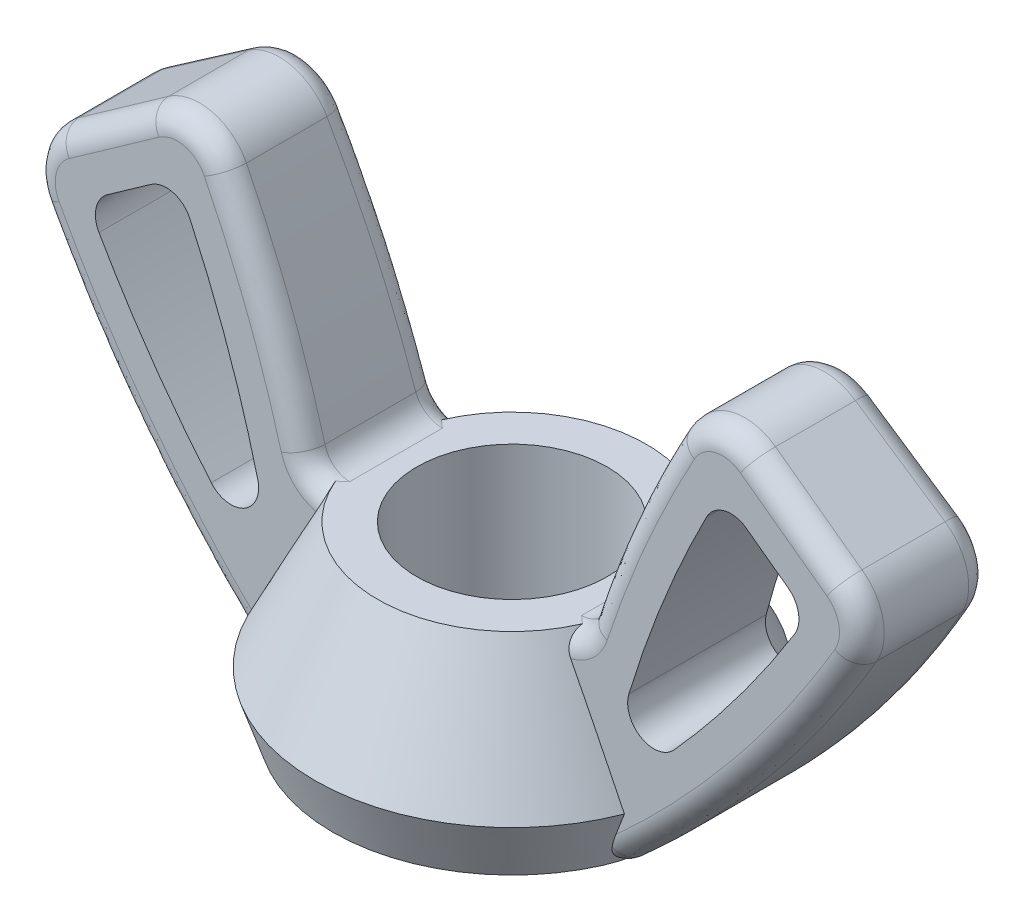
SolidWorks part; units mm, degrees
ref_plane "Front Plane" through (0, 0, 0) normal (0, 0, 1) x (1, 0, 0)
ref_plane "Top Plane" through (0, 0, 0) normal (0, 1, 0) x (1, 0, 0)
ref_plane "Right Plane" through (0, 0, 0) normal (1, 0, 0) x (0, 0, -1)
other "Configuration Table"
sketch "BaseNutSke" plane through (0, 0, 0) normal (0, 0, 1) x (1, 0, 0)
  line L0 (0, 0) -> (-8, 0)
  line L2 (-6, 8) -> (0, 8)
  line L3 (0, 8) -> (0, 0)
  line L4 (0, -38.5148) -> (0, 38.5148) construction
  line L5 (-6, 8) -> (-8.8, 2.4)
  line L6 (-8.8, 2.4) -> (-8, 0)
revolve "BaseNut" add sketch "BaseNutSke" angle 360 about L4
sketch "BaseWingSke" plane through (0, 0, 0) normal (1, 0, 0) x (0, 0, -1)
  line L0 (0, 0) -> (0, 62.8635) construction
  line L1 (-2.75, 19) -> (-3.25, 0)
  line L2 (-2.75, 19) -> (2.75, 19)
  line L3 (2.75, 19) -> (3.25, 0)
  line L4 (3.25, 0) -> (-3.25, 0)
  point P8 (0, 19)
  dimension "TopWing_Width" = 5.5
  dimension "BottomWing_Width" = 6.5
  dimension "Height" = 19
extrude "BaseWing" add sketch "BaseWingSke" along normal mid plane 37
sketch "CutWingSke" plane through (0, 0, 0) normal (0, 0, 1) x (1, 0, 0)
  line L0 (0, 0) -> (0, 84.5075) construction
  line L3 (18.5, 19) -> (-18.5, 19) construction
  line L4 (-18.5, 19) -> (-18.5, 0) construction
  line L5 (-7.3101, 0) -> (7.3101, 0) construction
  line L6 (5.1732, 8) -> (-5.1732, 8) construction
  line L7 (13.5447, 18.566) -> (17.4766, 15.8128)
  line L8 (-13.5447, 18.566) -> (-17.4766, 15.8128)
  line L9 (-7.3101, 0) -> (-18.5, 0) construction
  line L10 (-28.5, 29) -> (28.5, 29)
  line L11 (-28.5, 29) -> (-28.5, -10)
  line L12 (-28.5, -10) -> (28.5, -10)
  line L13 (28.5, 29) -> (28.5, -10)
  line L14 (18.5, 19) -> (18.5, 0) construction
  line L16 (-7.3101, 0) -> (7.3101, 0)
  line L17 (5.1732, 8) -> (-5.1732, 8)
  arc A0 (-5.1732, 8) -> (-6.3192, 8.8442) centre (-5.1732, 9.2) cw
  arc A1 (-7.3101, 0) -> (-8.1072, 0.303) centre (-7.3101, 1.2) cw
  arc A2 (-17.4766, 15.8128) -> (-18.1775, 12.6452) centre (-16.1, 13.8468) ccw
  arc A3 (-10.0553, 17.7386) -> (-13.5447, 18.566) centre (-12.1681, 16.6) ccw
  arc A4 (-10.0553, 17.7386) -> (-6.3192, 8.8442) centre (-54.0704, -5.9821) cw
  arc A5 (-18.1775, 12.6452) -> (-8.1072, 0.303) centre (25.1037, 37.68) ccw
  arc A6 (7.3101, 0) -> (8.1072, 0.303) centre (7.3101, 1.2) ccw
  arc A7 (18.1775, 12.6452) -> (8.1072, 0.303) centre (-25.1037, 37.68) cw
  arc A8 (17.4766, 15.8128) -> (18.1775, 12.6452) centre (16.1, 13.8468) cw
  arc A9 (10.0553, 17.7386) -> (13.5447, 18.566) centre (12.1681, 16.6) cw
  arc A10 (10.0553, 17.7386) -> (6.3192, 8.8442) centre (54.0704, -5.9821) ccw
  arc A11 (5.1732, 8) -> (6.3192, 8.8442) centre (5.1732, 9.2) ccw
extrude "CutWing" cut sketch "CutWingSke" against normal mid plane 37
sketch "HoleSke" plane through (0, 0, 0) normal (0, 1, 0) x (1, 0, 0)
  circle A0 centre (0, 0) radius 4.25
extrude "TappedHole" cut sketch "HoleSke" along normal through all
chamfer "Chamfer1" distance 0.5667 angle 60 1 edges at (0, 0, 4.25)
sketch "HollowSke" plane through (0, 0, 0) normal (0, 0, 1) x (1, 0, 0)
  line L0 (-13.2891, 15.815) -> (-15.1878, 14.4855)
  line L1 (13.2891, 15.815) -> (15.1878, 14.4855)
  line L2 (-13.5447, 18.566) -> (-17.4766, 15.8128) construction
  line L3 (0, 0) -> (0, 22.0794) construction
  arc A0 (-11.5283, 15.3704) -> (-8.282, 7.0249) centre (-54.0704, -5.9821) cw
  arc A1 (-15.5238, 12.8773) -> (-10.3296, 5.8957) centre (25.1037, 37.68) ccw
  arc A4 (-6.3192, 8.8442) -> (-10.0553, 17.7386) centre (-54.0704, -5.9821) ccw construction
  arc A5 (-18.1775, 12.6452) -> (-8.1072, 0.303) centre (25.1037, 37.68) ccw construction
  arc A6 (-13.2891, 15.815) -> (-11.5283, 15.3704) centre (-12.6008, 14.8321) cw
  arc A7 (-15.1878, 14.4855) -> (-15.5238, 12.8773) centre (-14.4995, 13.5026) ccw
  arc A8 (-8.282, 7.0249) -> (-10.3296, 5.8957) centre (-9.4364, 6.697) cw
  arc A9 (8.282, 7.0249) -> (10.3296, 5.8957) centre (9.4364, 6.697) ccw
  arc A10 (15.5238, 12.8773) -> (10.3296, 5.8957) centre (-25.1037, 37.68) cw
  arc A11 (15.1878, 14.4855) -> (15.5238, 12.8773) centre (14.4995, 13.5026) cw
  arc A12 (13.2891, 15.815) -> (11.5283, 15.3704) centre (12.6008, 14.8321) ccw
  arc A13 (11.5283, 15.3704) -> (8.282, 7.0249) centre (54.0704, -5.9821) ccw
extrude "HollowWing" cut sketch "HollowSke" against normal mid plane 10
fillet "Fillet1" radius 1 28 edges at (7.7364, 0.0783, -3.2479) (13.637, 6.0704, -3.0903) (18.4433, 14.3653, -2.872) (15.5106, 17.1894, -2.7976) (11.6143, 18.9352, -2.7517) (5.8849, 8.2338, -3.0333) (5.8849, 8.2338, 3.0333) (7.7364, 0.0783, 3.2479) (13.637, 6.0704, 3.0903) (18.4433, 14.3653, 2.872) (15.5106, 17.1894, 2.7976) (11.6143, 18.9352, 2.7517) (-5.8849, 8.2338, -3.0333) (-7.7364, 0.0783, -3.2479) (-13.637, 6.0704, -3.0903) (-18.4433, 14.3653, -2.872) (-15.5106, 17.1894, -2.7976) (-11.6143, 18.9352, -2.7517) (-7.7364, 0.0783, 3.2479) (-13.637, 6.0704, 3.0903) (-18.4433, 14.3653, 2.872) (-15.5106, 17.1894, 2.7976) (-11.6143, 18.9352, 2.7517) (-5.8849, 8.2338, 3.0333) (7.9723, 13.3817, -2.8978) (7.9723, 13.3817, 2.8978) (-7.9723, 13.3817, -2.8978) (-7.9723, 13.3817, 2.8978)
sketch "ThdSchSke" plane through (0, 0, 0) normal (0, 0, 1) x (1, 0, 0)
  line L0 (4.25, 0.5667) -> (3.384, 0.5667)
  line L1 (3.384, 0.5667) -> (3.384, 1.4327)
  line L2 (3.384, 1.4327) -> (4.25, 1.4327)
  line L3 (4.25, 1.4327) -> (5, 0.9997)
  line L4 (5, 0.9997) -> (4.25, 0.5667)
  line L5 (0, -3.4614) -> (0, 8.4929) construction
  line L6 (-4.25, 0.5667) -> (4.25, 0.5667) construction
revolve "ThreadSchematic" [suppressed] cut sketch "ThdSchSke" angle 360 about L5
pattern_linear "ThdSchPat" [suppressed]
equation "\"D1@BaseNutSke\" = \"Nut_Height@BaseNutSke\"*0.7"
equation "\"D2@BaseNutSke\" = \"Bottom_Width@BaseNutSke\"*1.1"
equation "\"D5@CutWingSke\" = \"Top_Width@BaseNutSke\"/10"
equation "\"D7@CutWingSke\" = \"Top_Width@BaseNutSke\"*0.2"
equation "\"D9@CutWingSke\" = \"Top_Width@BaseNutSke\"*0.4"
equation "\"D1@CutWing\" = \"Width@BaseWing\""
equation "\"D1@Chamfer1\" = \"Tap_drill@HoleSke\"/15"
equation "\"D1@HollowSke\" = \"Top_Width@BaseNutSke\"/5"
equation "\"D2@HollowSke\" = \"Top_Width@BaseNutSke\"/5"
equation "\"D3@HollowSke\" = \"Top_Width@BaseNutSke\"/5"
equation "\"D4@HollowSke\" = \"Top_Width@BaseNutSke\"/10"
equation "\"D1@Fillet1\" = \"Top_Width@BaseNutSke\"/12"
equation "\"D1@ThdSchSke\" = \"Tap_drill@HoleSke\""
equation "\"ThreadN@ThdSchSke\"=\"Thread_major@ThreadCosmetic\""
equation "\"Num_threads@ThdSchPat\" = int( \"Nut_Height@BaseNutSke\"/\"Advance@ThdSchPat\" ) +1"
